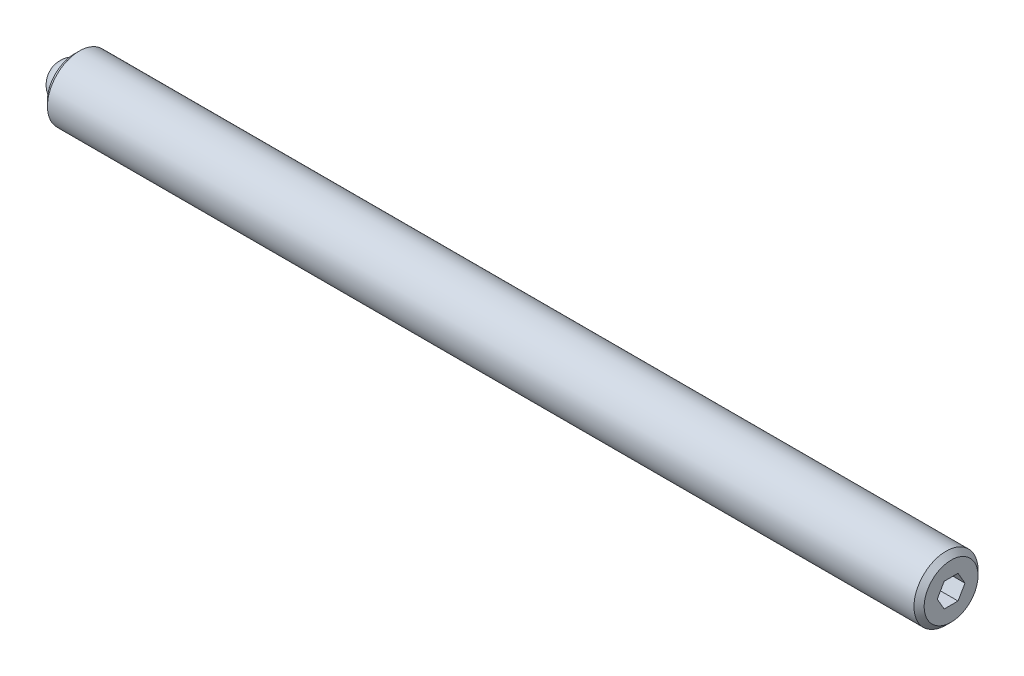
SolidWorks part; units mm, degrees
ref_plane "Front Plane" through (0, 0, 0) normal (0, 0, 1) x (1, 0, 0)
ref_plane "Top Plane" through (0, 0, 0) normal (0, 1, 0) x (1, 0, 0)
ref_plane "Right Plane" through (0, 0, 0) normal (1, 0, 0) x (0, 0, -1)
sketch "Sketch2" plane through (0, 0, 0) normal (1, 0, 0) x (0, 0, -1)
  circle A0 centre (0, 0) radius 3.175
  dimension "D1" = 6.35
extrude "Boss-Extrude1" add sketch "Sketch2" along normal blind 86.9156
sketch "Sketch3" plane through (0, 0, 0) normal (-1, 0, 0) x (0, 0, 1)
  circle A0 centre (0, 0) radius 1.9812
  dimension "D1" = 3.9624
chamfer "Chamfer1" distance 0.508 angle 45 1 edges at (0, 0, -3.175)
chamfer "Chamfer2" distance 0.508 angle 45 1 edges at (86.9156, 0, -3.175)
sketch "Sketch4" plane through (86.9156, 0, 0) normal (1, 0, 0) x (0, 0, -1)
  line L1 (1.3748, 0) -> (0.6874, 1.1906)
  line L2 (0.6874, 1.1906) -> (-0.6874, 1.1906)
  line L3 (-0.6874, 1.1906) -> (-1.3748, 0)
  line L4 (-1.3748, 0) -> (-0.6874, -1.1906)
  line L5 (-0.6874, -1.1906) -> (0.6874, -1.1906)
  line L6 (0.6874, -1.1906) -> (1.3748, 0)
  circle A0 centre (0, 0) radius 1.1906 construction
  dimension "D1" = 2.3813
extrude "Cut-Extrude2" cut sketch "Sketch4" against normal blind 2.286
extrude "Cut-Extrude3" cut sketch "Sketch3" against normal blind 1.9844
sketch "Sketch5" plane through (0, 0, 0) normal (-1, 0, 0) x (0, 0, 1)
  line L0 (0, 0) -> (0, -1.9844)
  line L1 (0, 0) -> (0, 1.9844)
  arc A0 (0, 1.9844) -> (0, -1.9844) centre (0, 0) ccw
  dimension "D1" = 1.9844
revolve "Revolve1" add sketch "Sketch5" angle 360 about L1
